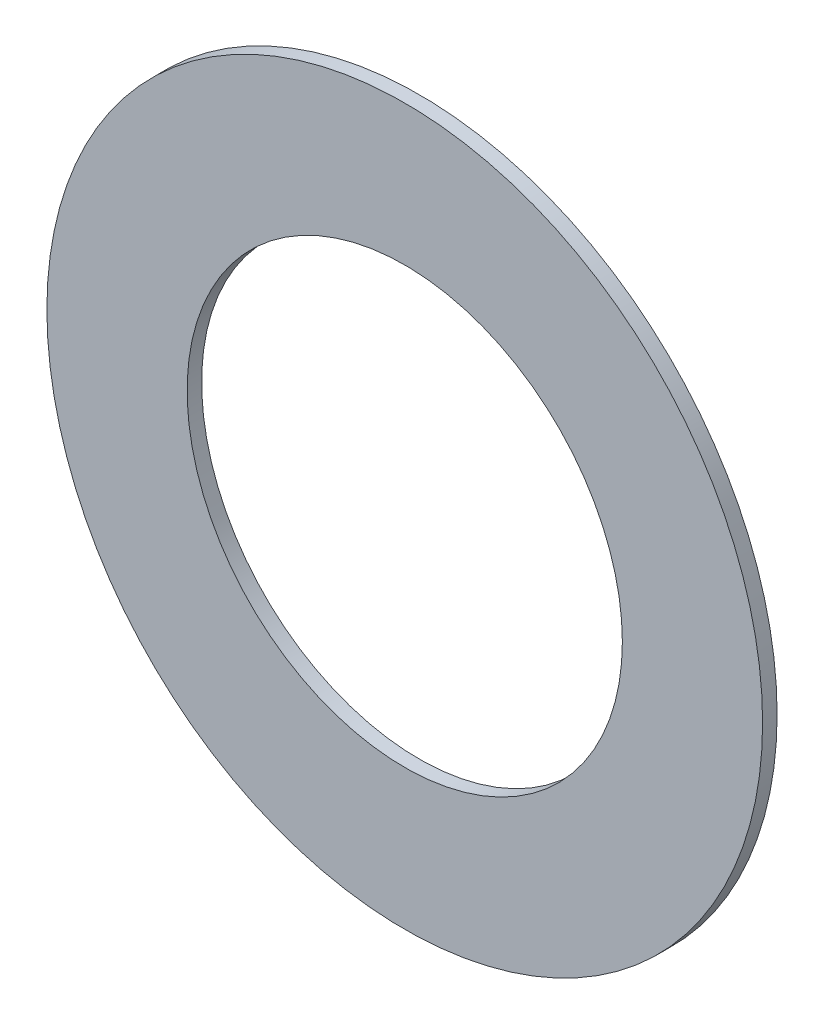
SolidWorks part; units mm, degrees
ref_plane "Plan1" through (0, 0, 0) normal (0, 0, 1) x (1, 0, 0)
ref_plane "Plan2" through (0, 0, 0) normal (0, 1, 0) x (1, 0, 0)
ref_plane "Plan3" through (0, 0, 0) normal (1, 0, 0) x (0, 0, -1)
sketch "Esquisse1" plane through (0, 0, 0) normal (0, 0, 1) x (1, 0, 0)
  circle A0 centre (0, 0) radius 37
  circle A1 centre (0, 0) radius 22.5
  dimension "D1" = 45
  dimension "D2" = 74
extrude "Base-Extrusion" add sketch "Esquisse1" along normal blind 1.5
